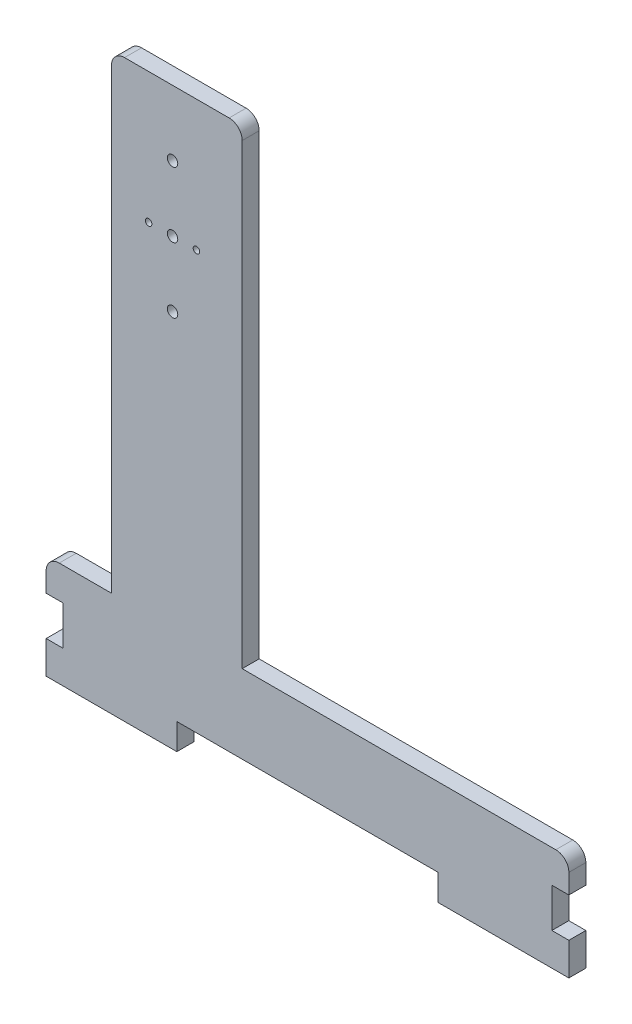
SolidWorks part; units mm, degrees
ref_plane "Alzado" through (0, 0, 0) normal (0, 0, 1) x (1, 0, 0)
ref_plane "Planta" through (0, 0, 0) normal (0, 1, 0) x (1, 0, 0)
ref_plane "Vista lateral" through (0, 0, 0) normal (1, 0, 0) x (0, 0, -1)
sketch "Croquis1" plane through (0, 0, 0) normal (0, 0, 1) x (1, 0, 0)
  line L0 (100, -40) -> (200, -40)
  line L1 (-200, -40) -> (-100, -40)
  line L2 (-200, -40) -> (-200, 40)
  line L3 (-200, 40) -> (-150, 40)
  line L4 (200, -40) -> (200, 40)
  line L5 (-100, -20) -> (100, -20)
  line L6 (-50, 40) -> (200, 40)
  line L8 (-100, -40) -> (-100, -20)
  line L10 (100, -40) -> (100, -20)
  line L12 (-150, 40) -> (-150, 400)
  line L13 (-150, 400) -> (-50, 400)
  line L14 (-50, 40) -> (-50, 400)
  point P0 (0, 0)
  dimension "D1" = 400
  dimension "D2" = 80
  dimension "D3" = 100
  dimension "D4" = 100
  dimension "D5" = 60
  dimension "D6" = 360
  dimension "D7" = 50
  dimension "D8" = 250
extrude "Saliente-Extruir1" add sketch "Croquis1" along normal blind 13
fillet "Redondeo3" radius 10 1 edges at (-150, 400, 6.5)
fillet "Redondeo4" radius 10 1 edges at (-50, 400, 6.5)
fillet "Redondeo5" radius 10 1 edges at (200, 40, 6.5)
fillet "Redondeo6" radius 10 1 edges at (-200, 40, 6.5)
sketch "Croquis2" plane through (0, 0, 13) normal (0, 0, 1) x (1, 0, 0)
  line L0 (200, -40) -> (200, 30) construction
  line L9 (200, 15) -> (187, 15)
  line L10 (200, 15) -> (200, -15)
  line L11 (200, -15) -> (187, -15)
  line L12 (187, 15) -> (187, -15)
  line L13 (0, 350) -> (0, 346) construction
  line L14 (0, 254) -> (0, 250) construction
  line L15 (0, 0) -> (0, 51.529) construction
  line L16 (-200, 15) -> (-200, -15)
  line L17 (-200, -15) -> (-187, -15)
  line L18 (-187, 15) -> (-187, -15)
  line L19 (-200, 15) -> (-187, 15)
  line L20 (-18.25, 300) -> (18.25, 300) construction
  line L21 (-103.2868, 350) -> (-103.2868, 250) construction
  line L22 (-50, 40) -> (-50, 390) construction
  line L23 (-150, 40) -> (-190, 40) construction
  line L24 (-60, 400) -> (-140, 400) construction
  circle A0 centre (0, 350) radius 4
  circle A2 centre (0, 250) radius 4
  circle A7 centre (18.25, 300) radius 2.5
  circle A8 centre (-18.25, 300) radius 2.5
  circle A9 centre (0, 300) radius 4
  circle A10 centre (-103.2868, 350) radius 4
  circle A12 centre (-103.2868, 300) radius 4
  circle A13 centre (-103.2868, 250) radius 4
  circle A14 centre (-84.9868, 300) radius 2.5
  circle A15 centre (-121.5868, 300) radius 2.5
  point P46 (0, 0)
  point P48 (-194.6186, 328.9668)
  dimension "D1" = 8
  dimension "D2" = 5
  dimension "D3" = 8
  dimension "D11" = 8
  dimension "D12" = 25
  dimension "D13" = 8
  dimension "D14" = 8
  dimension "D5" = 5
  dimension "D17" = 8
  dimension "D24" = 5
  dimension "D25" = 5
  dimension "D6" = 18.25
  dimension "D9" = 18.25
  dimension "D10" = 36.5
  dimension "D15" = 13
  dimension "D16" = 30
  dimension "D18" = 50
  dimension "D19" = 18.3
  dimension "D20" = 50
  dimension "D21" = 50
  dimension "D22" = 53.2868
  dimension "D23" = 18.3
extrude "Cortar-Extruir1" cut sketch "Croquis2" against normal blind 13
